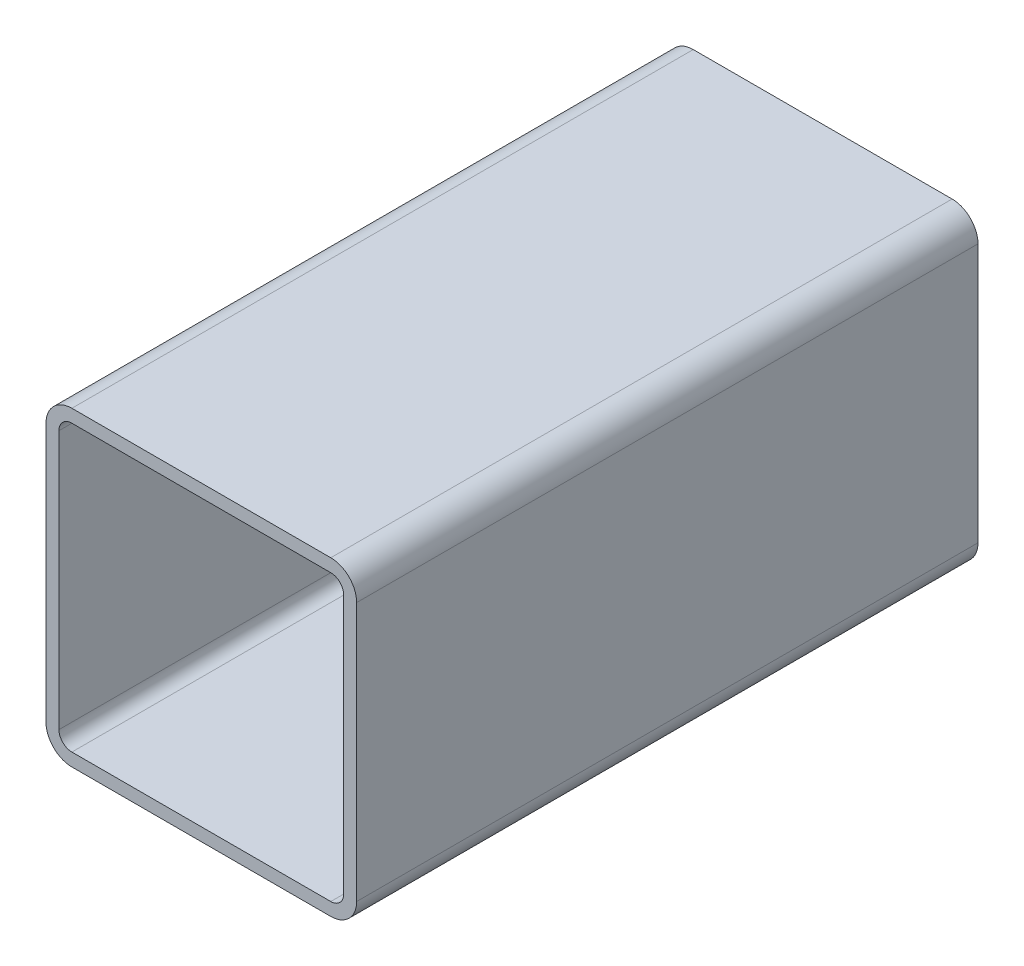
SolidWorks part; units mm, degrees
ref_plane "Front Plane" through (0, 0, 0) normal (0, 0, 1) x (1, 0, 0)
ref_plane "Top Plane" through (0, 0, 0) normal (0, 1, 0) x (1, 0, 0)
ref_plane "Right Plane" through (0, 0, 0) normal (1, 0, 0) x (0, 0, -1)
sketch "Sketch1" plane through (0, 0, 0) normal (0, 0, 1) x (1, 0, 0)
sketch_block_instance "HSS6x6x0.250-1"
sketch_block "HSS6x6x0.250"
extrude "Boss-Extrude1" add sketch "Sketch1" along normal blind 304.8
